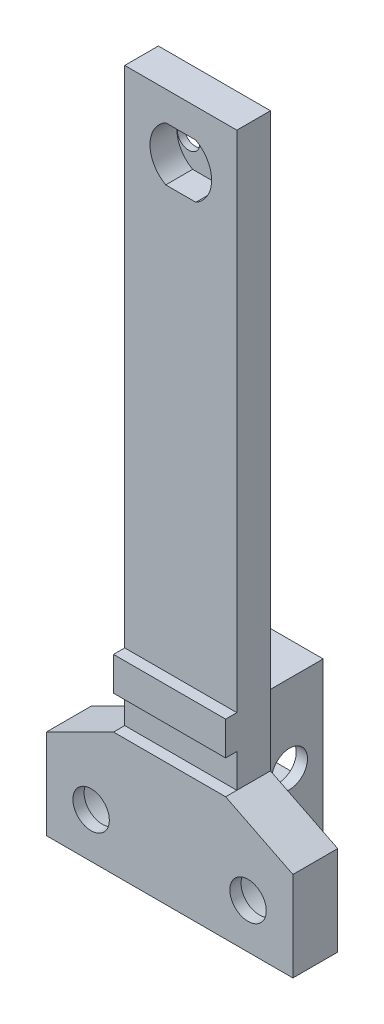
SolidWorks part; units mm, degrees
ref_plane "Front Plane" through (0, 0, 0) normal (0, 0, 1) x (1, 0, 0)
ref_plane "Top Plane" through (0, 0, 0) normal (0, 1, 0) x (1, 0, 0)
ref_plane "Right Plane" through (0, 0, 0) normal (1, 0, 0) x (0, 0, -1)
sketch "Croquis1" plane through (0, 0, 0) normal (0, 0, 1) x (1, 0, 0)
  line L1 (-5, -30) -> (5, -30)
  line L2 (-5, -30) -> (-5, 30)
  line L3 (-5, 30) -> (5, 30)
  line L4 (5, -30) -> (5, 30)
  line L5 (-5, -30) -> (5, 30) construction
  line L6 (-5, 30) -> (5, -30) construction
  point P0 (0, 0)
  dimension "D1" = 10
  dimension "D2" = 60
extrude "Saliente-Extruir1" add sketch "Croquis1" along normal blind 3
sketch "Croquis2" plane through (0, 0, 3) normal (0, 0, 1) x (1, 0, 0)
  line L0 (-5, 30) -> (-5, -30) construction
  line L1 (5, -30) -> (-5, -30)
  line L2 (5, -30) -> (5, -21)
  line L3 (5, -21) -> (-5, -21)
  line L4 (-5, -30) -> (-5, -21)
  line L5 (5, -30) -> (5, 30) construction
  line L6 (-5, -18) -> (5, -18)
  line L7 (-5, -18) -> (-5, -15)
  line L8 (-5, -15) -> (5, -15)
  line L9 (5, -18) -> (5, -15)
  dimension "D1" = 9
  dimension "D2" = 3
  dimension "D3" = 15
extrude "Saliente-Extruir2" add sketch "Croquis2" along normal blind 1
sketch "Croquis3" plane through (0, 0, 3) normal (0, 0, 1) x (1, 0, 0)
  line L0 (-1.3426, 27.4) -> (1.3426, 27.4)
  line L1 (-1.3426, 22.6) -> (1.3426, 22.6)
  line L4 (0, 0) -> (0, 52.9956) construction
  line L6 (5, 30) -> (-5, 30) construction
  arc A0 (-1.3426, 27.4) -> (-1.3426, 22.6) centre (0, 25) ccw
  arc A1 (1.3426, 22.6) -> (1.3426, 27.4) centre (0, 25) ccw
  dimension "D1" = 5.5
  dimension "D2" = 4.8
  dimension "D3" = 2.4
  dimension "D4" = 5
extrude "Cortar-Extruir1" cut sketch "Croquis3" against normal blind 2.4
sketch "Croquis4" plane through (0, 0, 0.6) normal (0, 0, 1) x (1, 0, 0)
  line L0 (0, 24.75) -> (0, 41.9806) construction
  line L1 (-1.3426, 22.6) -> (1.3426, 22.6) construction
  line L2 (1.3426, 27.4) -> (-1.3426, 27.4) construction
  circle A0 centre (-1.7, 24.9) radius 1
  circle A1 centre (1.7, 24.9) radius 1
  dimension "D1" = 2
  dimension "D2" = 2
  dimension "D3" = 3.4
  dimension "D4" = 1.7
  dimension "D5" = 2.15
  dimension "D6" = 2.5
extrude "Cortar-Extruir2" cut sketch "Croquis4" against normal blind 3
sketch "Croquis5" plane through (0, 0, 0) normal (0, 0, -1) x (-1, 0, 0)
  line L0 (5, -21) -> (11, -24)
  line L1 (11, -24) -> (11, -30)
  line L2 (11, -30) -> (5, -30)
  line L3 (5, -30) -> (5, -21)
  line L4 (-5, -21) -> (-11, -24)
  line L5 (-11, -24) -> (-11, -30)
  line L6 (-11, -30) -> (-5, -30)
  line L7 (-5, -30) -> (-5, -21)
extrude "Saliente-Extruir3" add sketch "Croquis5" against normal blind 4
sketch "Croquis8" plane through (0, 0, 0) normal (0, 0, -1) x (-1, 0, 0)
  line L1 (-11, -30) -> (11, -30)
  line L2 (-11, -30) -> (-11, -32)
  line L3 (-11, -32) -> (11, -32)
  line L4 (11, -30) -> (11, -32)
  dimension "D1" = 2
extrude "Saliente-Extruir4" add sketch "Croquis8" against normal blind 4
sketch "Croquis6" plane through (0, 0, 0) normal (0, 0, -1) x (-1, 0, 0)
  line L0 (11, -28) -> (-11, -28) construction
  line L1 (11, -32) -> (11, -24) construction
  line L2 (-11, -24) -> (-11, -32) construction
  circle A0 centre (7, -28) radius 3
  circle A1 centre (-7, -28) radius 3
  dimension "D1" = 6
  dimension "D2" = 6
  dimension "D3" = 4
  dimension "D4" = 4
extrude "Cortar-Extruir3" cut sketch "Croquis6" against normal blind 3
sketch "Croquis7" plane through (0, 0, 3) normal (0, 0, -1) x (-1, 0, 0)
  circle A0 centre (7, -28) radius 1.625
  circle A1 centre (-7, -28) radius 1.625
  dimension "D1" = 3.25
  dimension "D2" = 3.25
extrude "Cortar-Extruir4" cut sketch "Croquis7" against normal blind 4
sketch "Sketch1" plane through (0, 0, 0) normal (0, 0, -1) x (-1, 0, 0)
  line L0 (-20.2277, -23) -> (36.7875, -23) construction
  line L1 (-11, -32) -> (11, -32) construction
  line L2 (-3.7, -30) -> (3.7, -30)
  line L3 (-3.7, -30) -> (-3.7, -16)
  line L4 (-3.7, -16) -> (3.7, -16)
  line L5 (3.7, -30) -> (3.7, -16)
  line L6 (-3.7, -30) -> (3.7, -16) construction
  line L7 (-3.7, -16) -> (3.7, -30) construction
  line L9 (-2.7, -19.9) -> (0.5, -19.9)
  line L10 (-2.7, -19.9) -> (-2.7, -26.1)
  line L11 (-2.7, -26.1) -> (0.5, -26.1)
  line L12 (0.5, -19.9) -> (0.5, -26.1)
  point P2 (0, -23)
  dimension "D1" = 2
  dimension "D2" = 7.4
  dimension "D3" = 6.2
  dimension "D4" = 3.1
  dimension "D5" = 3.2
  dimension "D6" = 1
extrude "Boss-Extrude1" add sketch "Sketch1" along normal blind 6
sketch "Sketch2" plane through (3.7, 0, 0) normal (1, 0, 0) x (0, 0, -1)
  line L0 (3, -16) -> (3, -30) construction
  line L1 (6, -16) -> (0, -16) construction
  line L2 (6, -30) -> (0, -30) construction
  circle A0 centre (3, -23) radius 1.6
  dimension "D1" = 3.2
extrude "Cut-Extrude1" cut sketch "Sketch2" against normal blind 8
